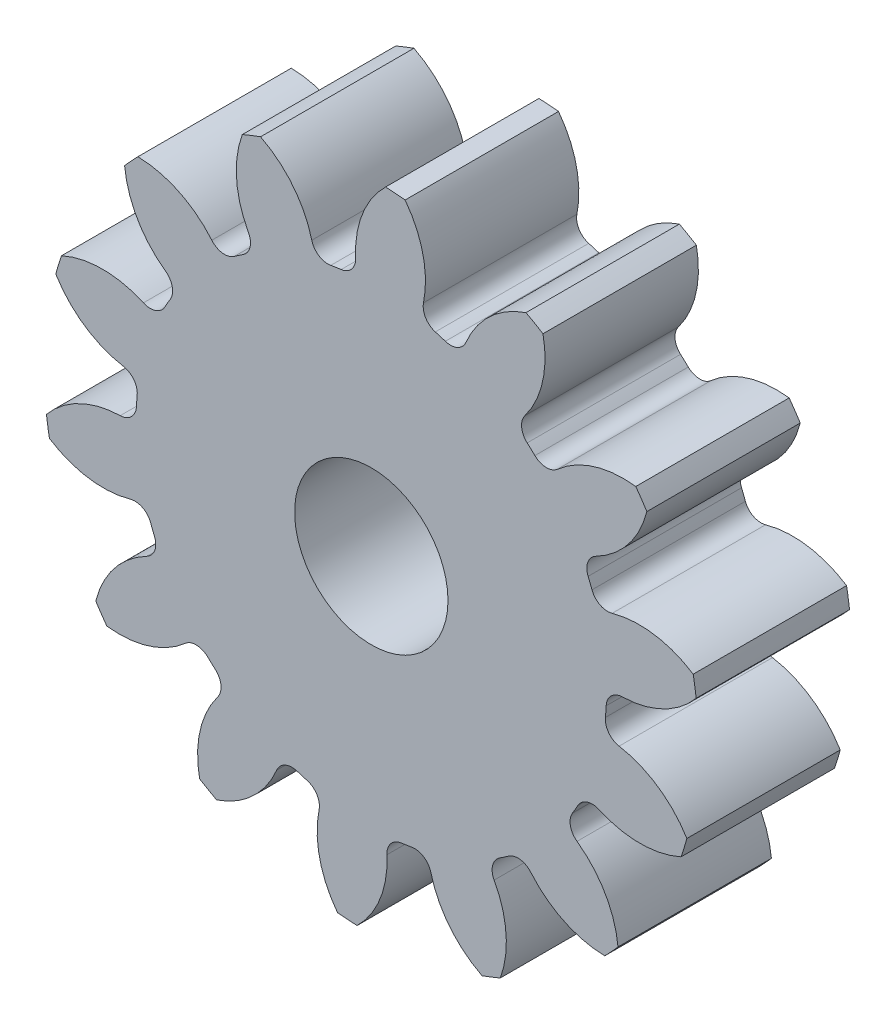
SolidWorks part; units mm, degrees
ref_plane "Front" through (0, 0, 0) normal (0, 0, 1) x (1, 0, 0)
ref_plane "Top" through (0, 0, 0) normal (0, 1, 0) x (1, 0, 0)
ref_plane "Right" through (0, 0, 0) normal (1, 0, 0) x (0, 0, -1)
sketch "Sketch3" plane through (0, 0, 0) normal (0, 0, 1) x (1, 0, 0)
  circle A0 centre (0, 0) radius 270.9333
  dimension "od" = 541.8667
extrude "gearBody" add sketch "Sketch3" along normal blind 127
sketch "Sketch2" plane through (0, 0, 0) normal (0, 0, 1) x (1, 0, 0)
  line L0 (0, 0) -> (205.8125, 85.2503) construction
  line L1 (262.8587, -74.4616) -> (0, 0) construction
  line L2 (0, 0) -> (36.3143, 0) construction
  line L3 (236.8889, 9.1802) -> (232.9855, -43.7989) construction
  line L5 (234.9372, -17.3093) -> (0, 0) construction
  line L7 (0, 0) -> (222.7698, 0) construction
  arc A0 (222.7173, 4.835) -> (219.6039, -37.4236) centre (0, 0) ccw construction
  arc A1 (268.9569, 32.6654) -> (261.2655, -71.7303) centre (0, 0) ccw construction
  arc A2 (236.8889, 9.1802) -> (232.9855, -43.7989) centre (0, 0) ccw construction
  arc A3 (193.8392, -18.6399) -> (194.4779, -9.9699) centre (0, 0) ccw
  arc A4 (262.8587, -74.4616) -> (205.1947, -33.5386) centre (191.0961, -114.4931) ccw
  arc A5 (262.8587, -74.4616) -> (270.9333, 35.1338) centre (0, 0) ccw
  arc A6 (270.9333, 35.1338) -> (207.8944, 3.1037) centre (205.8125, 85.2503) cw
  arc A7 (194.4779, -9.9699) -> (207.8944, 3.1037) centre (208.2436, -10.6756) cw
  arc A8 (205.1947, -33.5386) -> (193.8392, -18.6399) centre (207.5596, -19.9593) cw
  point P6 (270.9333, 35.1338)
  point P22 (262.8587, -74.4616)
  dimension "baseDia" = 445.5396
  dimension "od" = 541.8667
  dimension "pd" = 474.1333
  dimension "rd" = 389.4667
  dimension "rFillet" = 13.7837
  dimension "pointX" = 270.9333
  dimension "pointY" = 35.1338
  dimension "CTT" = 52.9791
  dimension "flankCenterAngle" = 22.5
extrude "toothCut" cut sketch "Sketch2" along normal through all
pattern_circular "CirPattern1" count 14 over 360 about axis through (0, 0, 0) along (0, 0, 1) of "toothCut"
sketch "hub1Dia" plane through (0, 0, 0) normal (0, 0, -1) x (-1, 0, 0)
  circle A0 centre (0, 0) radius 12.7
  dimension "hub1Dia" = 25.4
sketch "hub2Dia" plane through (0, 0, 127) normal (0, 0, 1) x (1, 0, 0)
  circle A0 centre (0, 0) radius 12.7
  dimension "hub2dia" = 25.4
sketch "boreDia" plane through (0, 0, 0) normal (0, 0, 1) x (1, 0, 0)
  circle A0 centre (0, 0) radius 63.5
  dimension "boreDia" = 127
extrude "bore" cut sketch "boreDia" against normal mid plane 25400
